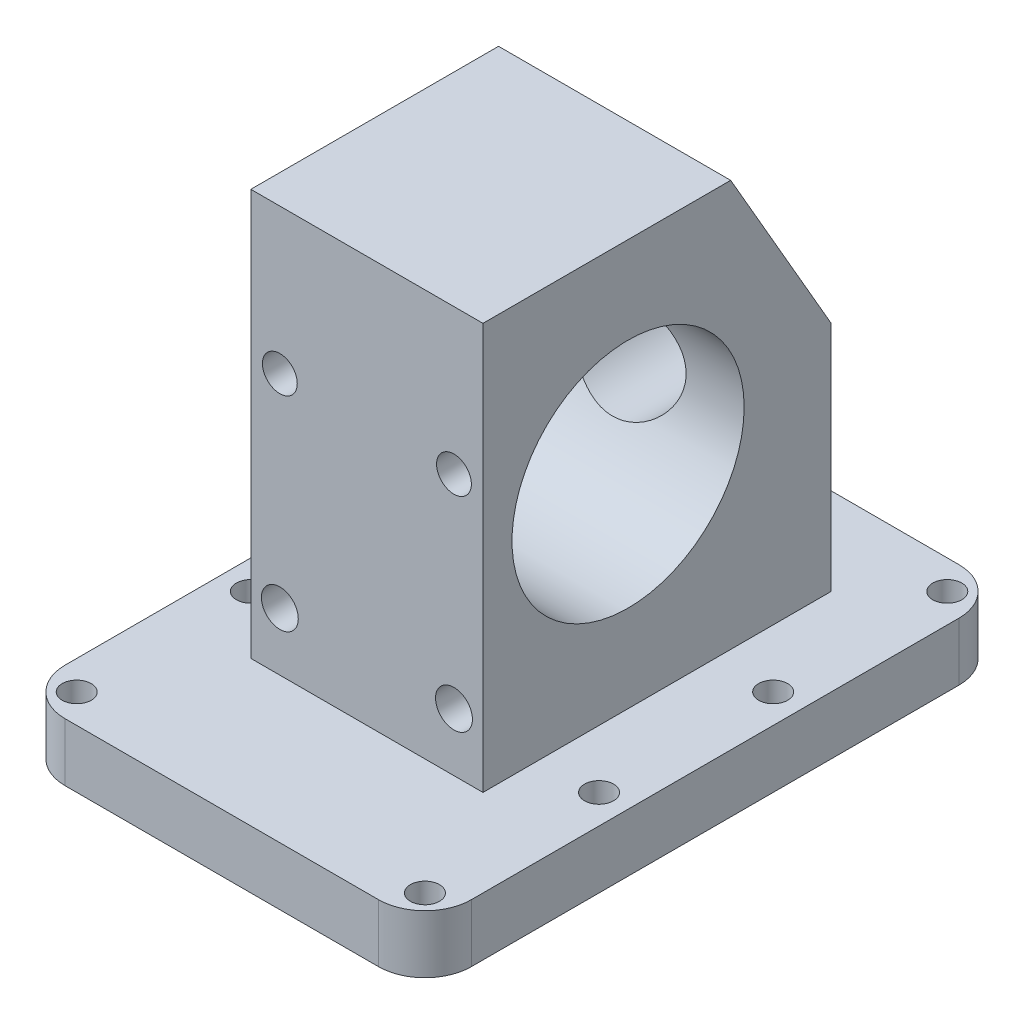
SolidWorks part; units mm, degrees
ref_plane "Front Plane" through (0, 0, 0) normal (0, 0, 1) x (1, 0, 0)
ref_plane "Top Plane" through (0, 0, 0) normal (0, 1, 0) x (1, 0, 0)
ref_plane "Right Plane" through (0, 0, 0) normal (1, 0, 0) x (0, 0, -1)
sketch "Sketch1" plane through (0, 0, 0) normal (1, 0, 0) x (0, 0, -1)
  line L1 (-25, 35) -> (35, 35)
  line L2 (-25, 35) -> (-25, -35)
  line L3 (-25, -35) -> (35, -35)
  line L4 (35, 35) -> (35, -35)
  point P0 (0, 0)
  point P6 (0, 0)
  dimension "D3" = 60
  dimension "D8" = 70
extrude "BODY" add sketch "Sketch1" along normal mid plane 40
sketch "Sketch17" plane through (20, 0, 0) normal (1, 0, 0) x (0, 0, -1)
  circle A0 centre (0, 0) radius 20
  dimension "D1" = 40
extrude "Big Hole" cut sketch "Sketch17" against normal through all
sketch "Sketch7" plane through (0, -35, 0) normal (0, -1, 0) x (1, 0, 0)
  line L0 (22, 0) -> (-22, 0) construction
  line L1 (35, 50) -> (-35, 50)
  line L2 (35, 50) -> (35, -50)
  line L3 (35, -50) -> (-35, -50)
  line L4 (-35, 50) -> (-35, -50)
  line L5 (35, 50) -> (-35, -50) construction
  line L6 (35, -50) -> (-35, 50) construction
  point P0 (0, 0)
  dimension "D2" = 70
  dimension "D3" = 100
extrude "BASE" add sketch "Sketch7" along normal blind 10
sketch "Sketch18" plane through (20, 0, 0) normal (1, 0, 0) x (0, 0, -1)
  line L0 (17.6795, 35) -> (35, 5)
  line L1 (35, 35) -> (-25, 35) construction
  line L2 (35, -35) -> (35, 35) construction
  line L3 (35, 5) -> (35, 35)
  line L4 (35, 35) -> (17.6795, 35)
  line L5 (50, -45) -> (-50, -45) construction
  dimension "D1" = 50
  dimension "D2" = 30
extrude "Cut-Extrude1_Slope_RIGHT" cut sketch "Sketch18" against normal through all
sketch "Sketch12" plane through (0, 0, -35) normal (0, 0, -1) x (-1, 0, 0)
  circle A0 centre (0, 0) radius 10.005
  dimension "D1" = 20.01
extrude "Cut-Extrude hole RIGHT" cut sketch "Sketch12" against normal up to next
hole_wizard "Ø6.0 (6) Diameter Hole1" positions "Sketch6" profile "Sketch5" hole size "Ø6.0" standard "ANSI Metric"
sketch "Sketch6" plane through (0, 0, 25) normal (0, 0, 1) x (1, 0, 0)
  line L2 (20, 35) -> (20, -35) construction
  line L3 (35, -45) -> (-35, -45) construction
  point P0 (15, 10)
  dimension "D1" = 5
  dimension "D2" = 55
sketch "Sketch5" plane through (15, 10, 25) normal (1, 0, 0) x (0, -1, 0)
  line L0 (0, 0) -> (0, 7.6795)
  line L1 (0, 7.6795) -> (3, 7.6795)
  line L2 (3, 7.6795) -> (3, 0)
  line L5 (3, 0) -> (0, 0)
  line L11 (0, -6.35) -> (0, 107.95) construction
  dimension "Thru Hole Dia." = 6
  dimension "Thru Hole Depth" = 7.6795
mirror "Mirror1" about plane through (0, 0, 0) normal (1, 0, 0) of "Ø6.0 (6) Diameter Hole1"
hole_wizard "1/4 (0.25) Diameter Hole1" positions "Sketch13" profile "Sketch14" hole size "1/4" standard "ANSI Inch"
sketch "Sketch13" plane through (0, 0, 25) normal (0, 0, 1) x (1, 0, 0)
  line L0 (20, 35) -> (20, -35) construction
  line L1 (35, -45) -> (-35, -45) construction
  point P0 (15, -25)
  dimension "D1" = 5
  dimension "D2" = 20
sketch "Sketch14" plane through (15, -25, 25) normal (1, 0, 0) x (0, -1, 0)
  line L0 (0, 0) -> (0, 75)
  line L1 (0, 75) -> (3.175, 75)
  line L2 (3.175, 75) -> (3.175, 0)
  line L5 (3.175, 0) -> (0, 0)
  line L11 (0, -6.35) -> (0, 107.95) construction
  dimension "Thru Hole Dia." = 6.35
  dimension "Thru Hole Depth" = 75
mirror "Mirror2" about plane through (0, 0, 0) normal (1, 0, 0) of "1/4 (0.25) Diameter Hole1"
hole_wizard "Ø5.0 (5) Diameter Hole1" positions "Sketch9" profile "Sketch10" hole size "Ø5.0" standard "ANSI Metric"
sketch "Sketch9" plane through (0, -35, 0) normal (0, 1, 0) x (-1, 0, 0)
  line L0 (35, 50) -> (35, -50) construction
  line L1 (-35, 50) -> (35, 50) construction
  point P0 (30, 45)
  dimension "D1" = 5
  dimension "D2" = 5
sketch "Sketch10" plane through (-30, -35, 45) normal (1, 0, 0) x (0, 0, 1)
  line L0 (0, 0) -> (0, 10)
  line L1 (0, 10) -> (2.5, 10)
  line L2 (2.5, 10) -> (2.5, 0)
  line L5 (2.5, 0) -> (0, 0)
  line L11 (0, -6.35) -> (0, 107.95) construction
  dimension "Thru Hole Dia." = 5
  dimension "Thru Hole Depth" = 10
pattern_linear "LPattern5" count 3 spacing 30 along (0, 0, -1) count 2 spacing 60 along (1, 0, 0) of "Ø5.0 (5) Diameter Hole1"
hole_wizard "M6x1.0 Tapped Hole1" positions "Sketch15" profile "Sketch16" tap size "M6x1.0" standard "ANSI Metric"
sketch "Sketch15" plane through (0, -35, 0) normal (0, 1, 0) x (1, 0, 0)
  line L0 (-35, 50) -> (35, 50) construction
  line L1 (35, 50) -> (35, -50) construction
  point P0 (-30, 45)
  point P2 (30, 45)
  dimension "D1" = 5
  dimension "D2" = 5
  dimension "D3" = 60
  dimension "D4" = 5
sketch "Sketch16" plane through (-30, -35, -45) normal (1, 0, 0) x (0, 0, 1)
  line L0 (0, 0) -> (0, 10)
  line L1 (0, 10) -> (2.5, 10)
  line L2 (2.5, 10) -> (2.5, 0)
  line L5 (2.5, 0) -> (0, 0)
  line L11 (0, -6.35) -> (0, 107.95) construction
  dimension "Thru Tap Drill Dia." = 5
  dimension "Thru Tap Drill Depth" = 10
fillet "Fillet1" radius 8 4 edges at (-35, -40, -50) (35, -40, -50) (35, -40, 50) (-35, -40, 50)
hole_wizard "M3x0.5 Tapped Hole1" positions "Sketch19" profile "Sketch20" tap size "M3x0.5" standard "ANSI Metric"
sketch "Sketch19" plane through (0, 16.4054, -28.4151) normal (0, 0.5, -0.866) x (-1, 0, 0)
  line L0 (-8.666, -13.1699) -> (-20, -13.1699) construction
  line L1 (-20, 21.4711) -> (-20, -13.1699) construction
  point P0 (-15, -3.1699)
  dimension "D1" = 10
  dimension "D2" = 5
sketch "Sketch20" plane through (15, 13.6603, -30) normal (1, 0, 0) x (0, 0.866, 0.5)
  line L0 (0, 0) -> (0, 8.2511)
  line L1 (0, 8.2511) -> (1.25, 7.5)
  line L2 (1.25, 7.5) -> (1.25, 0)
  line L5 (1.25, 0) -> (0, 0)
  line L10 (0, 8.2511) -> (-1.25, 7.5) construction
  line L11 (0, -6.35) -> (0, 107.95) construction
  dimension "Tap Drill Dia." = 2.5
  dimension "Tap Drill Depth" = 7.5
  dimension "Drill Angle" = 118
pattern_linear "LPattern6" count 4 spacing 10 along (-1, 0, 0) count 3 spacing 6 along (0, 0.866, 0.5) of "M3x0.5 Tapped Hole1"
